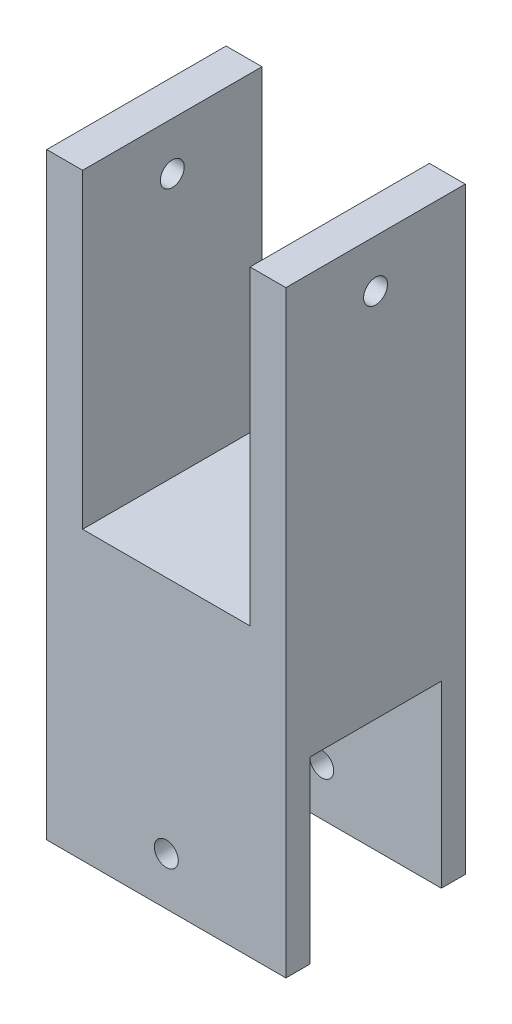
SolidWorks part; units mm, degrees
ref_plane "Plan de face" through (0, 0, 0) normal (0, 0, 1) x (1, 0, 0)
ref_plane "Plan de dessus" through (0, 0, 0) normal (0, 1, 0) x (1, 0, 0)
ref_plane "Plan de droite" through (0, 0, 0) normal (1, 0, 0) x (0, 0, -1)
sketch "Esquisse1" plane through (0, 0, 0) normal (0, 0, 1) x (1, 0, 0)
  line L0 (-21, 75) -> (-30, 75)
  line L1 (30, -75) -> (-30, -75)
  line L2 (30, -75) -> (30, 75)
  line L3 (30, 75) -> (21, 75)
  line L4 (-30, -75) -> (-30, 75)
  line L5 (30, -75) -> (-30, 75) construction
  line L6 (30, 75) -> (-30, -75) construction
  line L7 (21, -3) -> (-21, -3)
  line L8 (21, -3) -> (21, 75)
  line L10 (-21, -3) -> (-21, 75)
  line L11 (21, -3) -> (-21, 75) construction
  line L12 (21, 75) -> (-21, -3) construction
  circle A0 centre (0, -63) radius 3
  point P0 (0, 0)
  point P6 (0, 36)
  dimension "D5" = 6
  dimension "D1" = 60
  dimension "D2" = 150
  dimension "D3" = 42
  dimension "D4" = 78
  dimension "D6" = 12
extrude "Boss.-Extru.1" add sketch "Esquisse1" along normal mid plane 45
sketch "Esquisse2" plane through (0, 0, 0) normal (1, 0, 0) x (0, 0, -1)
  line L0 (-22.5, 75) -> (22.5, 75) construction
  line L1 (-22.5, -75) -> (22.5, -75) construction
  line L2 (16.5, -30) -> (-16.5, -30)
  line L3 (16.5, -30) -> (16.5, -75)
  line L4 (16.5, -75) -> (-16.5, -75)
  line L5 (-16.5, -30) -> (-16.5, -75)
  line L6 (16.5, -30) -> (-16.5, -75) construction
  line L7 (16.5, -75) -> (-16.5, -30) construction
  circle A0 centre (0, 63) radius 3
  point P6 (0, -52.5)
  dimension "D1" = 6
  dimension "D2" = 12
  dimension "D3" = 33
  dimension "D4" = 45
extrude "Enlèv. mat.-Extru.1" cut sketch "Esquisse2" against normal through all both and the other way through all
